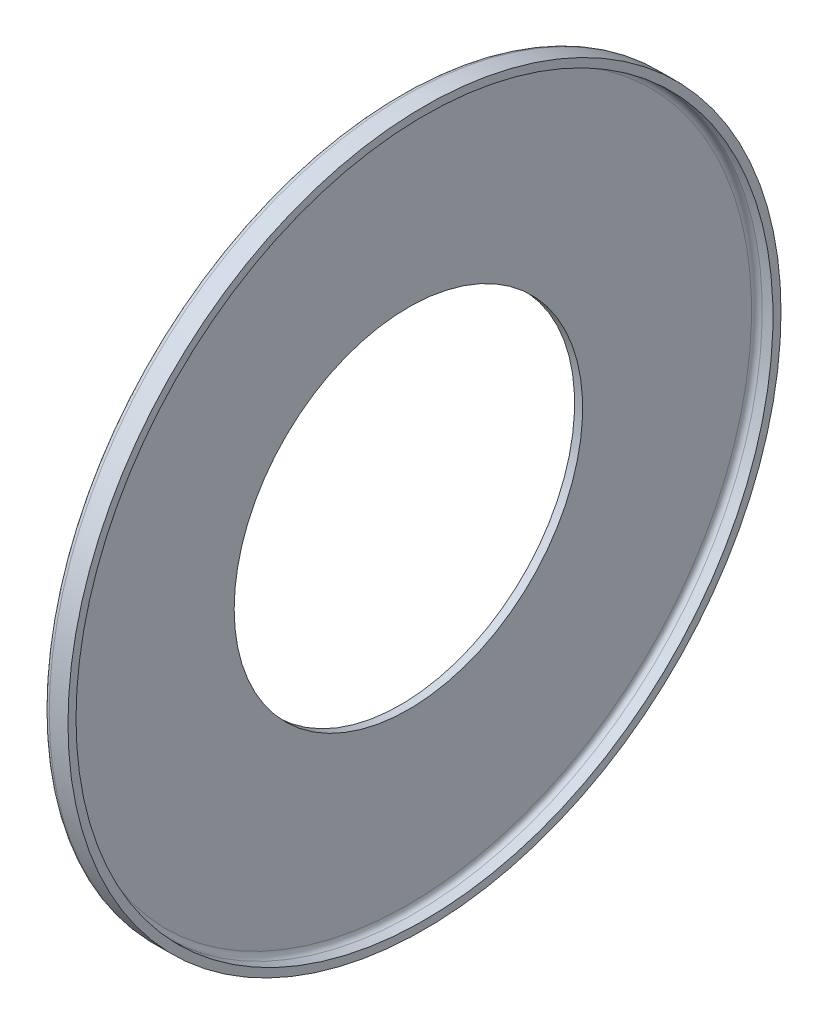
SolidWorks part; units mm, degrees
ref_plane "Plan1" through (0, 0, 0) normal (0, 0, 1) x (1, 0, 0)
ref_plane "Plan2" through (0, 0, 0) normal (0, 1, 0) x (1, 0, 0)
ref_plane "Plan3" through (0, 0, 0) normal (1, 0, 0) x (0, 0, -1)
sketch "Esquisse1" plane through (0, 0, 0) normal (0, 0, 1) x (1, 0, 0)
  line L0 (-100, 0) -> (100, 0) construction
  line L1 (-30, 65.5) -> (-30, 32.5)
  line L2 (-25.5, 66.5) -> (-25.5, 65)
  line L3 (-27.5, 65) -> (-25.5, 65)
  line L4 (-29, 66.5) -> (-25.5, 66.5)
  line L5 (-30, 32.5) -> (-28.5, 32.5)
  line L6 (-28.5, 64) -> (-28.5, 32.5)
  arc A0 (-29, 66.5) -> (-30, 65.5) centre (-29, 65.5) ccw
  arc A1 (-27.5, 65) -> (-28.5, 64) centre (-27.5, 64) ccw
  dimension "D4" = 1
  dimension "D1" = 65
  dimension "D2" = 1.5
  dimension "D3" = 32.5
  dimension "D5" = 1.5
revolve "Base-Révolution" add sketch "Esquisse1" angle 360 about L0
